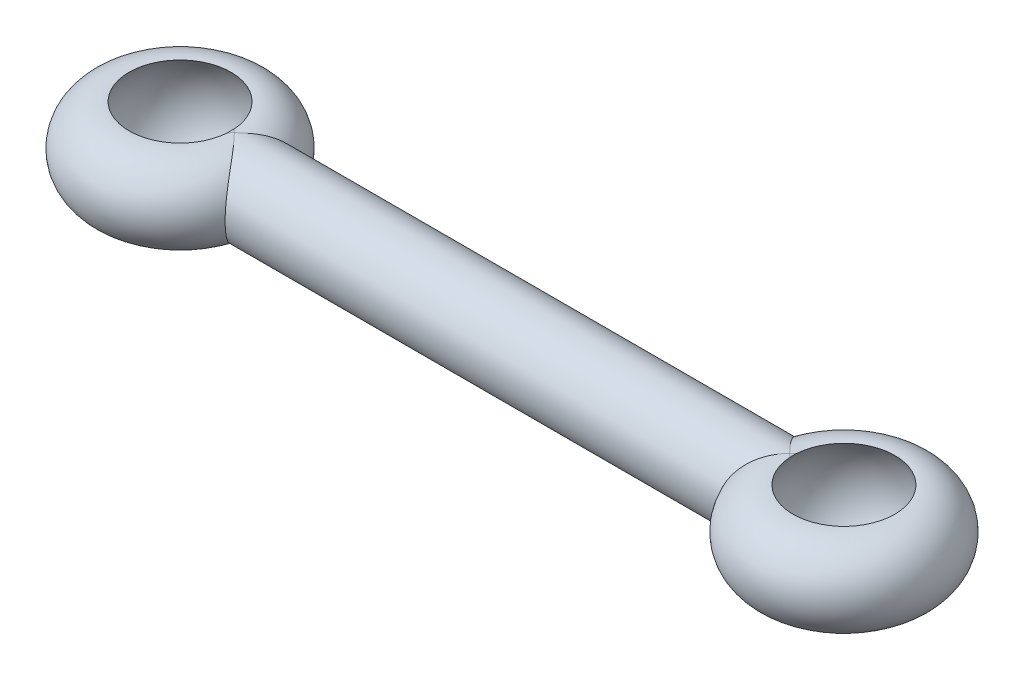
SolidWorks part; units mm, degrees
ref_plane "Face" through (0, 0, 0) normal (0, 0, 1) x (1, 0, 0)
ref_plane "Dessus" through (0, 0, 0) normal (0, 1, 0) x (1, 0, 0)
ref_plane "Droite" through (0, 0, 0) normal (1, 0, 0) x (0, 0, -1)
sketch "Esquisse1" plane through (0, 0, 0) normal (0, 0, 1) x (1, 0, 0)
  line L0 (0, 0) -> (0, 2.216) construction
  line L1 (1, 0) -> (0, 0) construction
  arc A0 (0.9387, -0.7475) -> (0.9387, 0.7475) centre (1, 0) ccw
  arc A1 (0.9387, 0.7475) -> (0.9387, -0.7475) centre (0, 0) cw
  dimension "D1" = 1.5
  dimension "D3" = 1.2
  dimension "D2" = 1
revolve "Révolution1" add sketch "Esquisse1" angle 360 about L0
sketch "Esquisse3" plane through (0, 0, 0) normal (0, 0, -1) x (1, 0, 0)
  line L0 (0, 0) -> (12.2418, 0) construction
  line L1 (12.2418, 0) -> (12.2418, 2.0425) construction
  line L2 (12.4624, -0.0238) -> (11.6617, 0.0626) construction
  arc A1 (11.303, -0.7475) -> (11.303, 0.7475) centre (12.2418, 0) cw
  arc A2 (11.303, 0.7475) -> (11.303, -0.7475) centre (11.2418, 0) ccw
  dimension "D2" = 0.75
  dimension "D3" = 1.2
  dimension "D1" = 1
revolve "Révolution2" add sketch "Esquisse3" angle 360 about L1
sketch "Esquisse4" plane through (0, 0, 0) normal (0, 1, 0) x (1, 0, 0)
  line L0 (0, 0) -> (12.2418, 0) construction
  line L2 (0.9367, 0.75) -> (11.305, 0.75)
  line L4 (11.0418, 0) -> (1.2, 0)
  circle A0 centre (0, 0) radius 1.2 construction
  arc A2 (11.0418, 0) -> (11.305, 0.75) centre (12.2418, 0) cw
  arc A3 (1.2, 0) -> (0.9367, 0.75) centre (0, 0) ccw
  dimension "D2" = 1.2
  dimension "D1" = 0.75
revolve "Révolution3" add sketch "Esquisse4" angle 360 about L0
ref_point "Point1"
